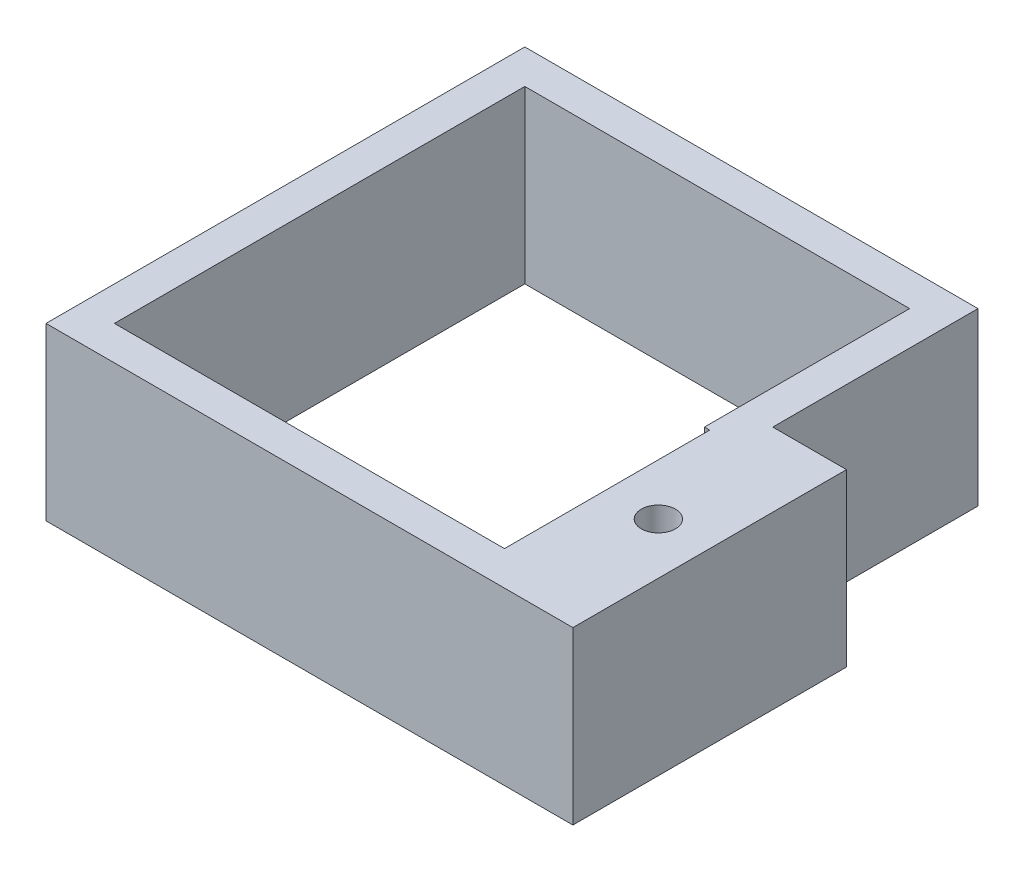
SolidWorks part; units mm, degrees
ref_plane "Front Plane" through (0, 0, 0) normal (0, 0, 1) x (1, 0, 0)
ref_plane "Top Plane" through (0, 0, 0) normal (0, 1, 0) x (1, 0, 0)
ref_plane "Right Plane" through (0, 0, 0) normal (1, 0, 0) x (0, 0, -1)
sketch "Sketch1" plane through (0, 0, 0) normal (0, 1, 0) x (1, 0, 0)
  line L0 (0, 0) -> (0, 28)
  line L1 (0, 28) -> (26.5, 28)
  line L2 (26.5, 28) -> (26.5, 16)
  line L3 (26.5, 16) -> (30.81, 16)
  line L4 (30.81, 16) -> (30.81, 0)
  line L5 (30.81, 0) -> (0, 0)
  line L6 (24.81, 6.7391) -> (24.81, 14)
  line L7 (24.81, 14) -> (24.5, 14)
  line L8 (24.5, 14) -> (24.5, 26)
  line L9 (24.5, 26) -> (2, 26)
  line L10 (2, 26) -> (2, 2)
  line L11 (2, 2) -> (24.81, 2)
  line L12 (24.81, 2) -> (24.81, 6.7391)
  dimension "D1" = 12
  dimension "D2" = 30.81
  dimension "D3" = 26.5
  dimension "D4" = 28
  dimension "D5" = 6
  dimension "D6" = 2
  dimension "D7" = 2
  dimension "D8" = 2
  dimension "D9" = 2
  dimension "D10" = 2
extrude "Boss-Extrude1" add sketch "Sketch1" along normal blind 10
sketch "Sketch2" plane through (0, 10, 0) normal (0, 1, 0) x (1, 0, 0)
  line L0 (24.81, 14) -> (30.81, 14)
  line L1 (30.81, 0) -> (30.81, 16) construction
  line L2 (30.81, 14) -> (30.81, 2)
  line L3 (30.81, 2) -> (24.81, 2)
  line L4 (24.81, 2) -> (24.81, 14)
  line L5 (24.81, 14) -> (30.81, 2)
  line L6 (30.81, 14) -> (24.81, 2)
  circle A0 centre (27.81, 8) radius 1
  dimension "D1" = 2
extrude "Cut-Extrude1" cut sketch "Sketch2" against normal through all contours L5 A0 L6 | L6 A0 L5 | L5 A0 L6 | L6 A0 L5
